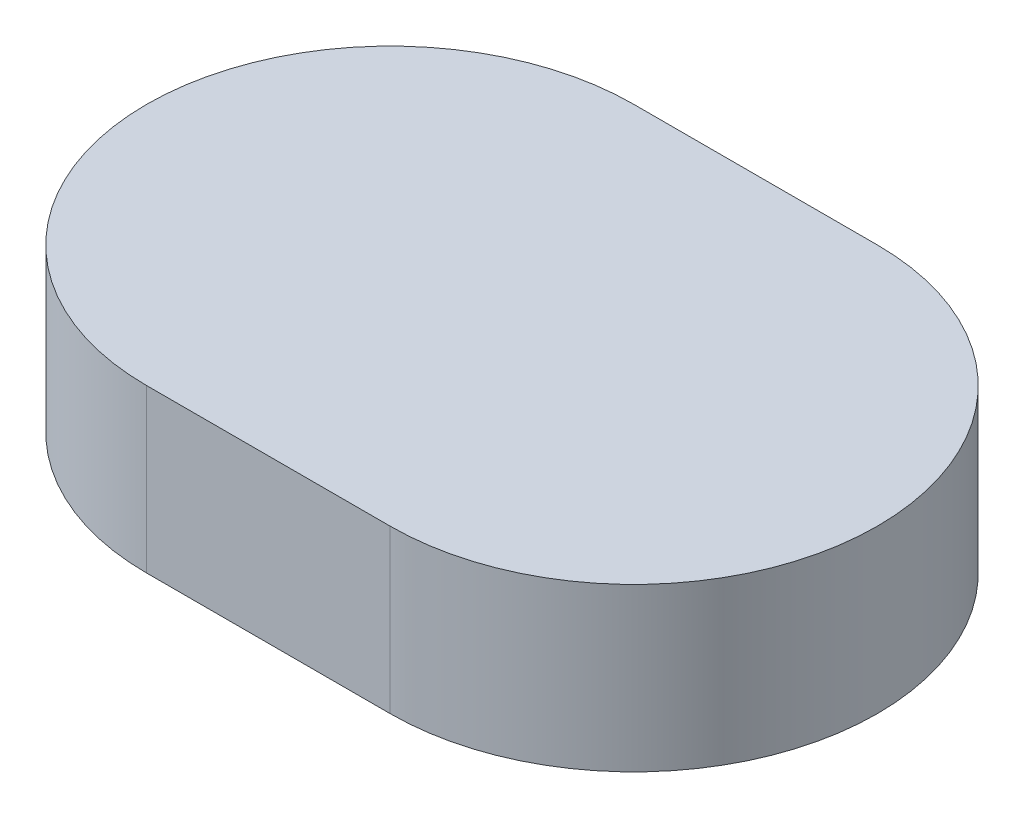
SolidWorks part; units mm, degrees
ref_plane "Plan de face" through (0, 0, 0) normal (0, 0, 1) x (1, 0, 0)
ref_plane "Plan de dessus" through (0, 0, 0) normal (0, 1, 0) x (1, 0, 0)
ref_plane "Plan de droite" through (0, 0, 0) normal (1, 0, 0) x (0, 0, -1)
sketch "Esquisse1" plane through (0, 0, 0) normal (0, 1, 0) x (1, 0, 0)
  line L0 (-1.5, 0) -> (1.5, 0) construction
  line L1 (-1.5, 3) -> (1.5, 3)
  line L2 (-1.5, -3) -> (1.5, -3)
  arc A0 (-1.5, 3) -> (-1.5, -3) centre (-1.5, 0) ccw
  arc A1 (1.5, -3) -> (1.5, 3) centre (1.5, 0) ccw
  point P2 (0, 0)
  dimension "D2" = 3
  dimension "D1" = 3
extrude "Boss.-Extru.1" add sketch "Esquisse1" along normal blind 2
